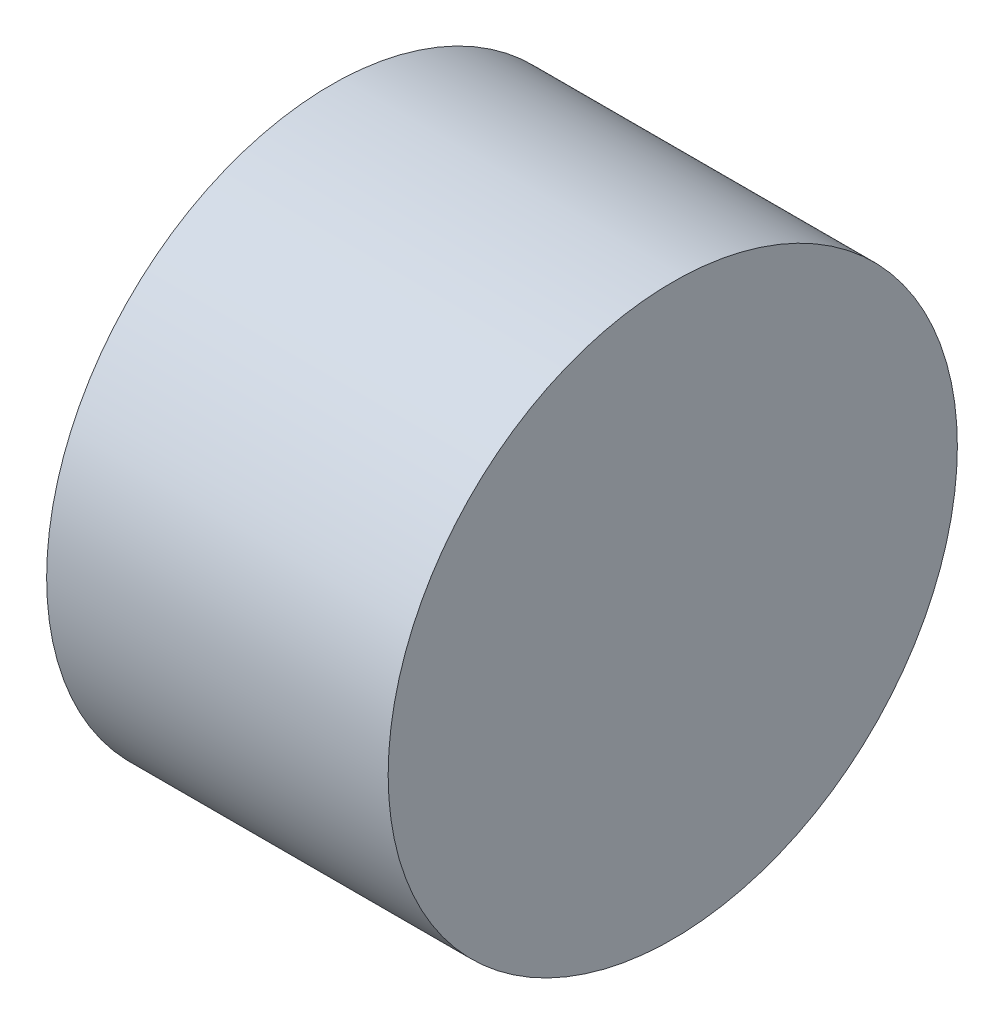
SolidWorks part; units mm, degrees
ref_plane "前视基准面" through (0, 0, 0) normal (0, 0, 1) x (1, 0, 0)
ref_plane "上视基准面" through (0, 0, 0) normal (0, 1, 0) x (1, 0, 0)
ref_plane "右视基准面" through (0, 0, 0) normal (1, 0, 0) x (0, 0, -1)
sketch "草图1" plane through (0, 0, 0) normal (1, 0, 0) x (0, 0, -1)
  circle A0 centre (0, 0) radius 25
  dimension "D1" = 50
extrude "拉伸1" add sketch "草图1" along normal blind 30
